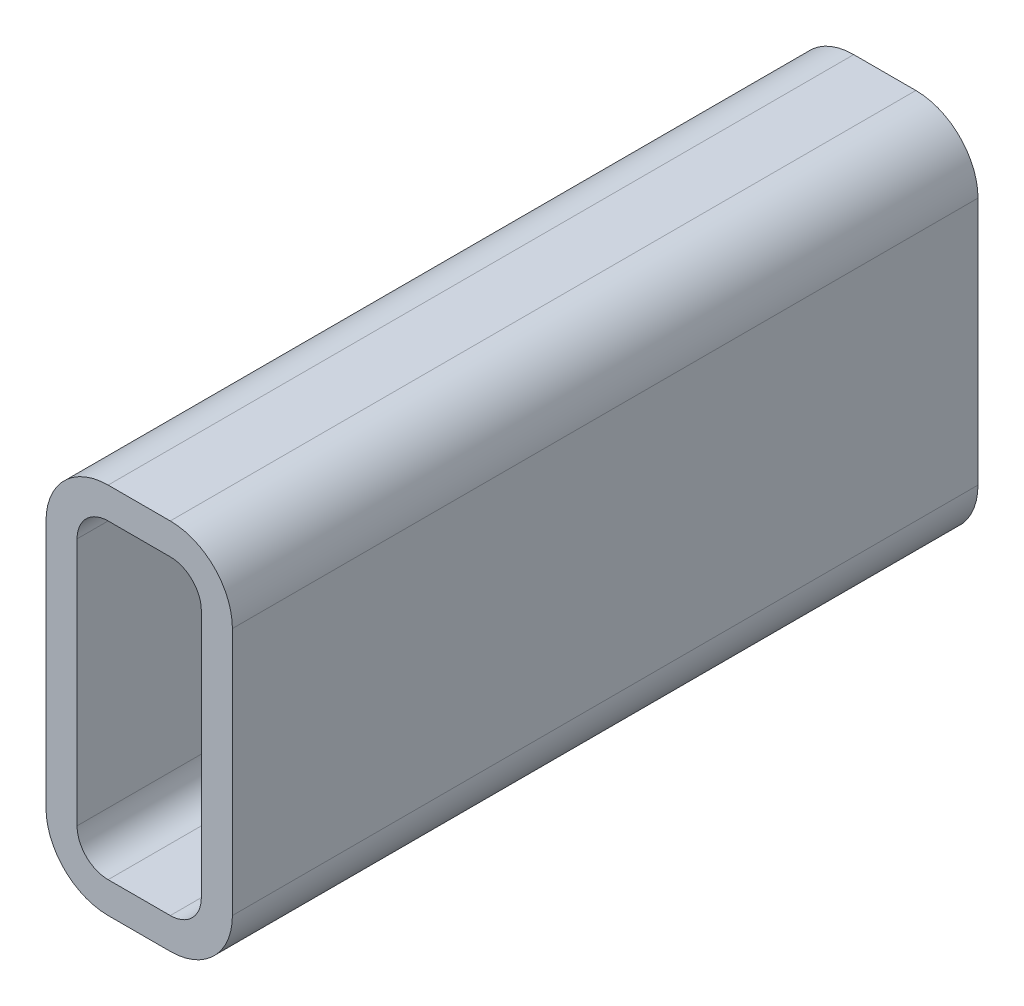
SolidWorks part; units mm, degrees
ref_plane "Front Plane" through (0, 0, 0) normal (0, 0, 1) x (1, 0, 0)
ref_plane "Top Plane" through (0, 0, 0) normal (0, 1, 0) x (1, 0, 0)
ref_plane "Right Plane" through (0, 0, 0) normal (1, 0, 0) x (0, 0, -1)
sketch "Sketch1" plane through (0, 0, 0) normal (0, 0, 1) x (1, 0, 0)
sketch_block_instance "HSS6x3x0.500-1"
sketch_block "HSS6x3x0.500"
extrude "Boss-Extrude1" add sketch "Sketch1" along normal blind 304.8
